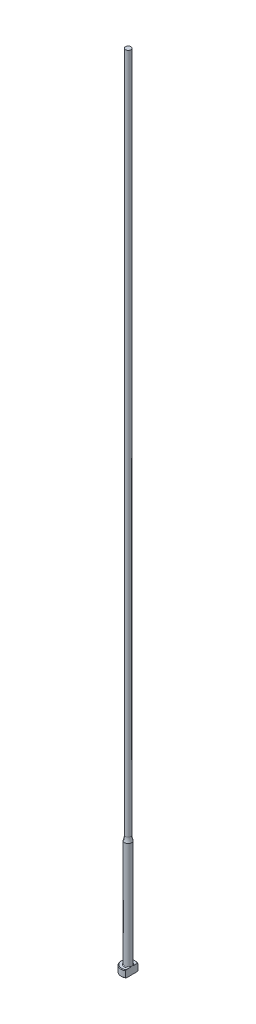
SolidWorks part; units mm, degrees
ref_plane "Front Plane" through (0, 0, 0) normal (0, 0, 1) x (1, 0, 0)
ref_plane "Top Plane" through (0, 0, 0) normal (0, 1, 0) x (1, 0, 0)
ref_plane "Right Plane" through (0, 0, 0) normal (1, 0, 0) x (0, 0, -1)
sketch "Sketch1" plane through (0, 0, 0) normal (0, 0, 1) x (1, 0, 0)
  line L0 (0, 259.9588) -> (0, -15.1925) construction
  line L1 (0, 0) -> (-3.175, 0)
  line L2 (-3.175, 0) -> (-3.175, 3.175)
  line L3 (-3.175, 3.175) -> (-1.5875, 3.175)
  line L4 (-1.19, 53.0114) -> (-1.19, 355.6)
  line L5 (-1.19, 355.6) -> (0, 355.6)
  line L6 (0, 355.6) -> (0, 0)
  line L7 (-1.5875, 3.175) -> (-1.5875, 50.8)
  arc A0 (-1.5875, 50.8) -> (-1.19, 53.0114) centre (-7.54, 53.0114) ccw
  point P13 (-1.5875, 0)
  dimension "D1" = 6.35
  dimension "L" = 355.6
  dimension "D2" = 3.175
  dimension "H" = 6.35
  dimension "T" = 3.175
  dimension "D" = 2.38
  dimension "S" = 50.8
revolve "Revolve1" add sketch "Sketch1" angle 360 about L0
chamfer "Chamfer1" distance 0.254 angle 45 2 edges at (0, 3.175, 3.175) (0, 0, 3.175)
fillet "Fillet1" radius 0.254 1 edges at (0, 3.175, 1.5875)
sketch "Sketch2" plane through (0, 0, 0) normal (0, 1, 0) x (1, 0, 0)
  line L0 (1.5875, -2.7496) -> (1.5875, 2.7496)
  circle A0 centre (0, 0) radius 3.175 construction
  arc A2 (1.5875, -2.7496) -> (1.5875, 2.7496) centre (0, 0) ccw
  circle A3 centre (0, 0) radius 3.175 construction
  circle A4 centre (0, 0) radius 1.5875 construction
extrude "Key Head" cut sketch "Sketch2" along normal up to next
